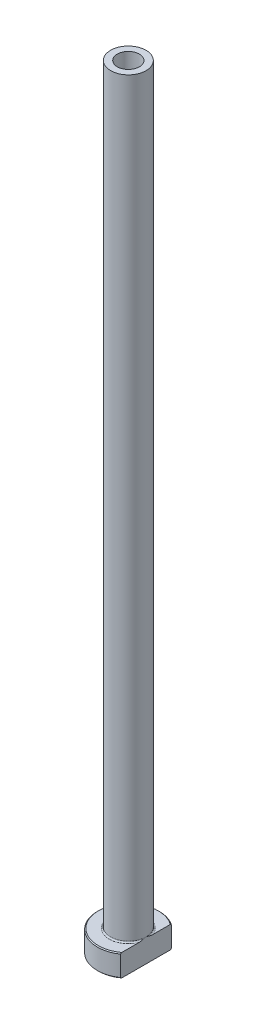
SolidWorks part; units mm, degrees
ref_plane "Front Plane" through (0, 0, 0) normal (0, 0, 1) x (1, 0, 0)
ref_plane "Top Plane" through (0, 0, 0) normal (0, 1, 0) x (1, 0, 0)
ref_plane "Right Plane" through (0, 0, 0) normal (1, 0, 0) x (0, 0, -1)
sketch "Sketch1" plane through (0, 0, 0) normal (0, 0, 1) x (1, 0, 0)
  line L0 (-2.5, 175) -> (-4, 175)
  line L1 (-4, 175) -> (-4, 5)
  line L2 (-4, 5) -> (-7, 5)
  line L3 (-7, 5) -> (-7, 0)
  line L4 (6.05, 0) -> (-6.05, 0) construction
  line L5 (-7, 0) -> (-2.75, 0)
  line L6 (-2.5, 130) -> (-2.5, 175)
  line L7 (0, 92.1877) -> (0, -15.5353) construction
  line L8 (0, -7.7) -> (0, 7.7) construction
  line L9 (-2.5, 130) -> (-2.75, 118)
  line L10 (-2.75, 118) -> (-2.75, 0)
  dimension "D1" = 0.25
  dimension "ID" = 5
  dimension "OD" = 8
  dimension "L" = 175
  dimension "H" = 14
  dimension "T" = 5
  dimension "N" = 45
  dimension "D2" = 12
  dimension "L-N" = 130
revolve "Revolve1" add sketch "Sketch1" angle 360 about L7
fillet "Fillet1" radius 0.3 1 edges at (0, 5, 4)
chamfer "Chamfer1" distance 0.2 angle 45 2 edges at (0, 5, 7) (0, 0, 7)
sketch "Sketch2" plane through (0, 0, 0) normal (0, -1, 0) x (1, 0, 0)
  line L0 (4, 5.7446) -> (4, -5.7446)
  circle A0 centre (0, 0) radius 7 construction
  arc A1 (4, 5.7446) -> (4, -5.7446) centre (0, 0) cw
  circle A2 centre (0, 0) radius 4 construction
extrude "Cut-Extrude1" cut sketch "Sketch2" against normal through all
chamfer "Chamfer2" distance 0.5 angle 45 1 edges at (0, 0, 2.75)
